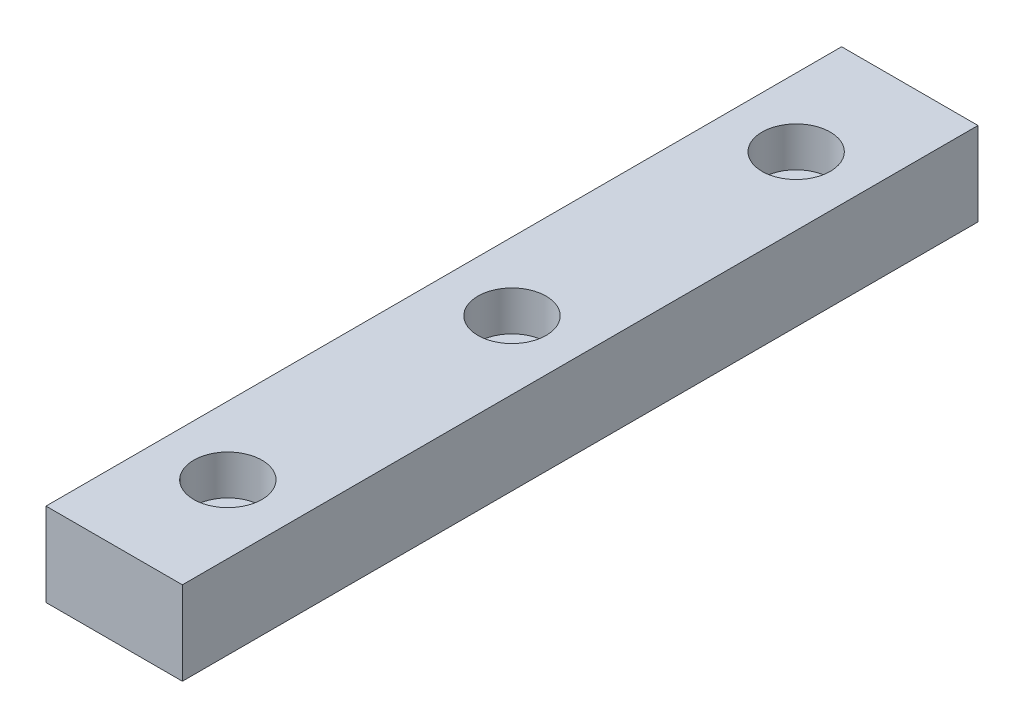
SolidWorks part; units mm, degrees
ref_plane "前视基准面" through (0, 0, 0) normal (0, 0, 1) x (1, 0, 0)
ref_plane "上视基准面" through (0, 0, 0) normal (0, 1, 0) x (1, 0, 0)
ref_plane "右视基准面" through (0, 0, 0) normal (1, 0, 0) x (0, 0, -1)
sketch "草图1" plane through (0, 0, 0) normal (0, 0, 1) x (1, 0, 0)
  line L0 (0, 0) -> (12, 0)
  line L1 (0, 0) -> (0, 7.35)
  line L2 (12, 0) -> (12, 7.35)
  line L3 (0, 7.35) -> (12, 7.35)
extrude "凸台-拉伸1" add sketch "草图1" along normal blind 70
sketch "草图2" plane through (0, 7.35, 0) normal (0, 1, 0) x (1, 0, 0)
  circle A0 centre (6, -60) radius 1.75
  circle A1 centre (6, -35) radius 1.75
  circle A2 centre (6, -10) radius 1.75
extrude "切除-拉伸1" cut sketch "草图2" against normal blind 70
sketch "草图4" plane through (0, 7.35, 0) normal (0, 1, 0) x (1, 0, 0)
  circle A0 centre (6, -60) radius 3
  circle A1 centre (6, -35) radius 3
  circle A2 centre (6, -10) radius 3
extrude "切除-拉伸2" cut sketch "草图4" against normal blind 3.5
